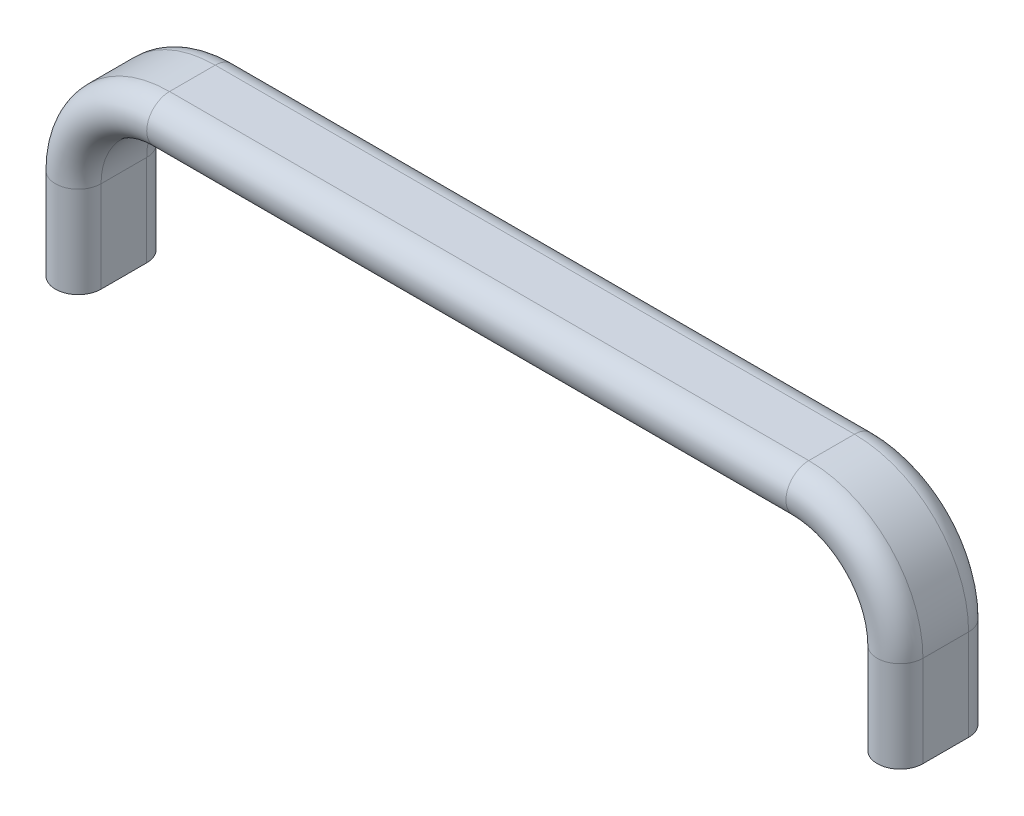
SolidWorks part; units mm, degrees
ref_plane "Front Plane" through (0, 0, 0) normal (0, 0, 1) x (1, 0, 0)
ref_plane "Top Plane" through (0, 0, 0) normal (0, 1, 0) x (1, 0, 0)
ref_plane "Right Plane" through (0, 0, 0) normal (1, 0, 0) x (0, 0, -1)
sketch "Sketch1" plane through (0, 0, 0) normal (0, 0, 1) x (1, 0, 0)
  line L0 (-90, 0) -> (-90, 20)
  line L1 (-70, 40) -> (70, 40)
  line L2 (0, 0) -> (0, 50000) construction
  line L3 (90, 0) -> (90, 20)
  arc A0 (-90, 20) -> (-70, 40) centre (-70, 20) cw
  arc A1 (90, 20) -> (70, 40) centre (70, 20) ccw
  point P9 (0, 40)
  dimension "D3" = 20
  dimension "D1" = 180
  dimension "D2" = 40
sketch "Sketch2" plane through (0, 0, 0) normal (0, 1, 0) x (1, 0, 0)
  line L0 (-95, -5) -> (-95, 5)
  line L1 (-85, 5) -> (-85, -5)
  line L2 (0, 0) -> (-50000, 0) construction
  line L3 (-90, -10) -> (-90, 10) construction
  arc A0 (-95, 5) -> (-85, 5) centre (-90, 5) cw
  arc A1 (-95, -5) -> (-85, -5) centre (-90, -5) ccw
  point P0 (-90, 10)
  point P6 (-95, 0)
  point P10 (-85, 0)
  point P11 (-90, -10)
  point P15 (-90, 0)
  dimension "D1" = 10
  dimension "D2" = 20
sweep "Sweep1" add profiles "Sketch2" path "Sketch1"
sketch "Sketch3" plane through (0, 0, 0) normal (0, -1, 0) x (1, 0, 0)
  circle A0 centre (-90, 0) radius 2.1
  dimension "D1" = 4.2
  dimension "D2" = 90
extrude "Extrude1" cut sketch "Sketch3" against normal blind 12.5
sketch "Sketch4" plane through (0, 0, 0) normal (0, -1, 0) x (1, 0, 0)
  circle A0 centre (-90, 0) radius 2.5
  dimension "D1" = 5
extrude "Extrude2" cut sketch "Sketch4" against normal blind 10
sketch "Sketch5" plane through (0, 0, 0) normal (0, 0, 1) x (1, 0, 0)
  line L0 (-90, 12.5) -> (-92.1, 12.5)
  line L1 (-92.1, 12.5) -> (-90, 13.7124)
  line L2 (-90, 13.7124) -> (-90, 12.5)
  dimension "D1" = 30
  dimension "D2" = 2.1
  dimension "D3" = 12.5
  dimension "D4" = 90
revolve "Cut-Revolve1" cut sketch "Sketch5" angle 360 about L2
mirror "Mirror1" about plane through (0, 0, 0) normal (1, 0, 0) of "Cut-Revolve1", "Extrude2", "Extrude1"
equation "\"D2@Sketch3\" = \"D1@Sketch1\"/2"
equation "\"D2@Sketch5\" = \"D1@Sketch3\"/2"
equation "\"D3@Sketch5\" = \"D1@Extrude1\""
equation "\"D4@Sketch5\" = \"D1@Sketch1\"/2"
